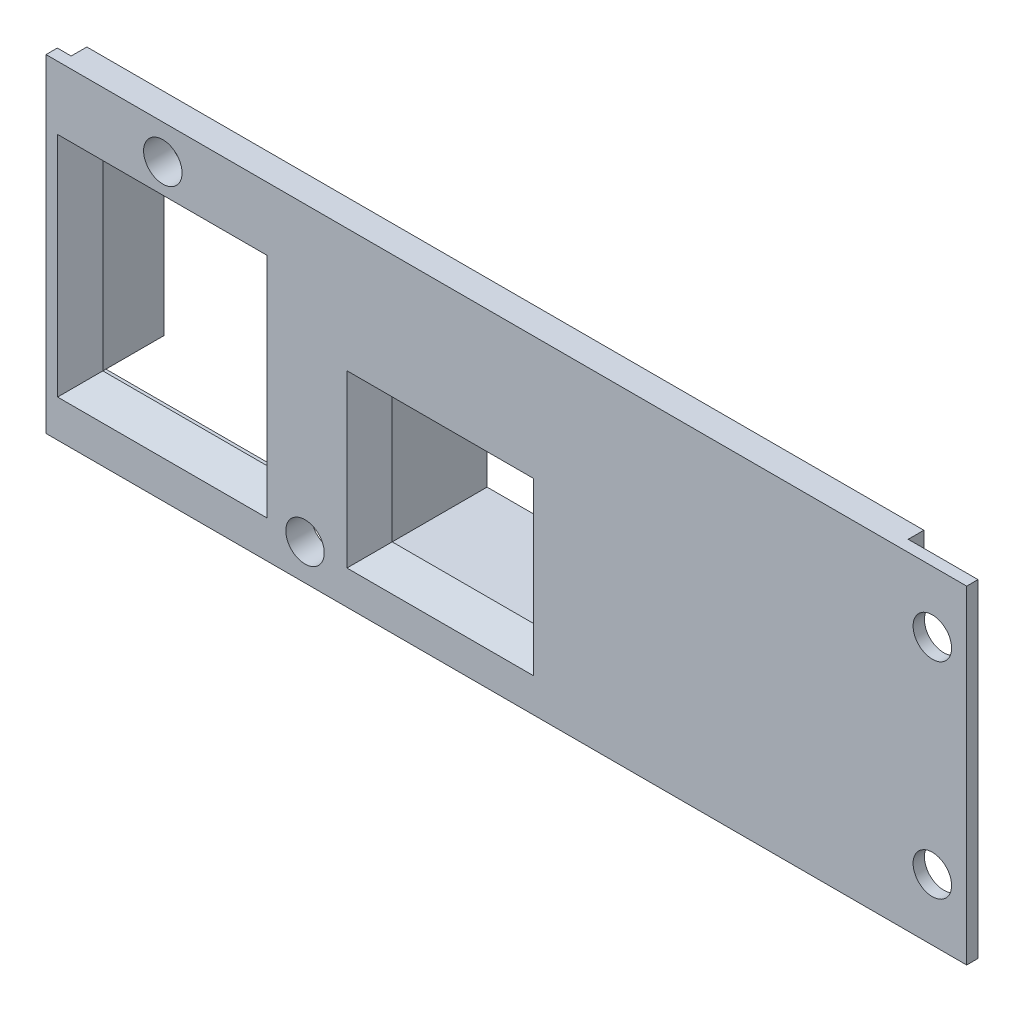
SolidWorks part; units mm, degrees
ref_plane "Front Plane" through (0, 0, 0) normal (0, 0, 1) x (1, 0, 0)
ref_plane "Top Plane" through (0, 0, 0) normal (0, 1, 0) x (1, 0, 0)
ref_plane "Right Plane" through (0, 0, 0) normal (1, 0, 0) x (0, 0, -1)
sketch "Skizze1" plane through (0, 0, 0) normal (0, 0, 1) x (1, 0, 0)
  line L5 (0, 0) -> (0, 29)
  line L6 (0, 29) -> (81.365, 29)
  line L9 (0, 0) -> (81.365, 0)
  line L10 (81.365, 0) -> (81.365, 29)
  line L11 (81.365, 29) -> (81.365, 0) construction
  line L12 (75.2956, 29) -> (81.365, 29) construction
extrude "Aufsatz-Linear austragen1" add sketch "Skizze1" along normal blind 1
sketch "Skizze2" plane through (0, 0, 0) normal (0, 0, -1) x (-1, 0, 0)
  line L1 (-81.365, 29) -> (0, 29) construction
  line L3 (-75.1956, 1.1) -> (-1.2247, 1.1)
  line L4 (-1.2247, 1.1) -> (-1.2247, 29)
  line L5 (-1.2247, 29) -> (-75.1956, 29)
  line L6 (-75.1956, 1.1) -> (-75.1956, 29)
  line L7 (-75.2956, 29) -> (-75.2956, 1) construction
  line L8 (-1.1247, 1) -> (-75.2956, 1) construction
  line L9 (-1.1247, 29) -> (-1.1247, 1) construction
  dimension "D1" = 0.1
  dimension "D2" = 0.1
  dimension "D3" = 0.1
extrude "Aufsatz-Linear austragen2" add sketch "Skizze2" along normal up to vertex
sketch "Skizze3" plane through (0, 0, -1.3855) normal (0, 0, -1) x (-1, 0, 0)
  line L1 (-77.5859, 16.2496) -> (-19.7247, 16.2496) construction
  line L2 (-58.9956, 16.2496) -> (-41.0956, 16.2496)
  line L4 (-75.1956, 29) -> (-75.1956, 1.1) construction
  line L5 (-41.0956, 4.7) -> (-58.9956, 4.7)
  line L6 (-21.8956, 3.5) -> (-21.8956, 5) construction
  line L7 (-41.0956, 4.7) -> (-41.0956, 16.2496)
  line L9 (-58.9956, 4.7) -> (-58.9956, 16.2496)
  line L10 (-21.7956, 4.7) -> (-75.2956, 4.7) construction
  dimension "D1" = 16.2
  dimension "D2" = 19.2
extrude "Aufsatz-Linear austragen3" add sketch "Skizze3" along normal up to vertex
sketch "Skizze4" plane through (0, 0, -1.3855) normal (0, 0, -1) x (-1, 0, 0)
  line L5 (-17.5247, 21.4) -> (-3.0247, 21.4)
  line L6 (-3.0247, 21.4) -> (-3.0247, 5.3)
  line L7 (-3.0247, 5.3) -> (-17.5247, 5.3)
  line L8 (-17.5247, 5.3) -> (-17.5247, 21.4)
extrude "Schnitt-Linear austragen1" cut sketch "Skizze4" against normal blind 8
sketch "Skizze5" plane through (0, 0, -1.3855) normal (0, 0, -1) x (-1, 0, 0)
  line L0 (-19.0247, 22.9) -> (-19.0247, 5.3)
  line L2 (-19.0247, 5.3) -> (-17.5247, 5.3)
  line L3 (-17.5247, 5.3) -> (-17.5247, 21.4)
  line L4 (-17.5247, 21.4) -> (-3.0247, 21.4)
  line L5 (-3.0247, 21.4) -> (-3.0247, 5.3)
  line L6 (-3.0247, 5.3) -> (-1.2247, 5.3)
  line L7 (-1.2247, 5.3) -> (-1.2247, 22.9)
  line L9 (-1.2247, 22.9) -> (-19.0247, 22.9)
  line L10 (-1.2247, 1.1) -> (-1.2247, 29) construction
  dimension "D1" = 1.5
  dimension "D2" = 1.5
extrude "Aufsatz-Linear austragen4" add sketch "Skizze5" along normal blind 5
sketch "Skizze6" plane through (0, 0, -1.3855) normal (0, 0, -1) x (-1, 0, 0)
  line L0 (-41.0956, 5) -> (-28.5956, 5)
  line L1 (-28.5956, 5) -> (-28.5956, 16.1)
  line L2 (-28.5956, 16.1) -> (-41.0956, 16.1)
  line L4 (-41.0956, 5) -> (-41.0956, 16.1)
  line L6 (-41.0956, 4.7) -> (-41.0956, 16.2496) construction
  line L7 (-48.7982, 5) -> (-44.2483, 5) construction
  line L9 (-42.8956, 5) -> (-62.7956, 5) construction
  dimension "D1" = 12.5
  dimension "D2" = 11.1
extrude "Schnitt-Linear austragen2" cut sketch "Skizze6" against normal through all
sketch "Skizze7" plane through (0, 0, -1.3855) normal (0, 0, -1) x (-1, 0, 0)
  line L0 (-28.5956, 5) -> (-28.5956, 16.2496)
  line L2 (-26.5956, 16.2496) -> (-26.5956, 3)
  line L5 (-26.5956, 3) -> (-43.0956, 3)
  line L6 (-34.8456, 5) -> (-34.8456, 7.3406) construction
  line L7 (-41.0956, 5) -> (-28.5956, 5) construction
  line L8 (-28.5956, 5) -> (-41.0956, 5)
  line L9 (-41.0956, 16.2496) -> (-43.0956, 16.2496)
  line L11 (-43.0956, 16.2496) -> (-43.0956, 3)
  line L12 (-28.5956, 16.2496) -> (-26.5956, 16.2496)
  line L13 (-41.0956, 5) -> (-41.0956, 16.2496)
  line L14 (-28.5956, 5) -> (-28.5956, 16.1) construction
  line L15 (-10.5179, 16.2496) -> (22.4564, 16.2496) construction
  line L16 (-41.0956, 16.2496) -> (-58.9956, 16.2496) construction
  line L17 (-77.5859, 16.2496) -> (-19.7247, 16.2496) construction
  point P12 (-34.8456, 3)
  dimension "D1" = 2
  dimension "D2" = 2
extrude "Aufsatz-Linear austragen5" add sketch "Skizze7" along normal blind 8
chamfer "Fase2" distance 2 angle 45
sketch "Skizze8" plane through (0, 0, 0) normal (0, 0, -1) x (-1, 0, 0)
  circle A0 centre (-78.3303, 23.5848) radius 1.7
  circle A1 centre (-78.3303, 5.4152) radius 1.7
  dimension "D1" = 3.4
extrude "Schnitt-Linear austragen3" cut sketch "Skizze8" against normal blind 12
sketch "Skizze10" plane through (0, 0, -1.3855) normal (0, 0, -1) x (-1, 0, 0)
  line L0 (-1.1247, 5.3) -> (-26.5956, 5.3)
  line L1 (-26.5956, 5.3) -> (-26.5956, 1.1)
  line L2 (-75.1956, 1.1) -> (-1.2247, 1.1) construction
  line L3 (-26.5956, 1.1) -> (-1.2247, 1.1)
  line L4 (-1.2247, 1.1) -> (-1.1247, 5.3)
  line L5 (-26.5956, 3) -> (-26.5956, 16.2496) construction
extrude "Schnitt-Linear austragen5" cut sketch "Skizze10" against normal up to vertex
sketch "Skizze11" plane through (0, 0, -1.2709) normal (0, 0, -1) x (-1, 0, 0)
  circle A0 centre (-22.891, 3.15) radius 1.7
  dimension "D1" = 3.4
extrude "Schnitt-Linear austragen6" cut sketch "Skizze11" against normal blind 12
chamfer "Fase3" distance 3 angle 45
sketch "Skizze12" plane through (0, 0, -1.3855) normal (0, 0, -1) x (-1, 0, 0)
  line L0 (-1.2247, 29) -> (-1.2247, 22.9) construction
  line L3 (-19.4247, 22.9) -> (-19.4247, 29) construction
  line L4 (-1.2247, 29) -> (-75.1956, 29) construction
  line L5 (-1.2247, 25.95) -> (-19.4247, 25.95) construction
  line L6 (-1.2247, 22.9) -> (-1.2247, 29) construction
  circle A0 centre (-10.3247, 25.95) radius 1.7
  dimension "D1" = 3.4
extrude "Schnitt-Linear austragen7" cut sketch "Skizze12" against normal through all
